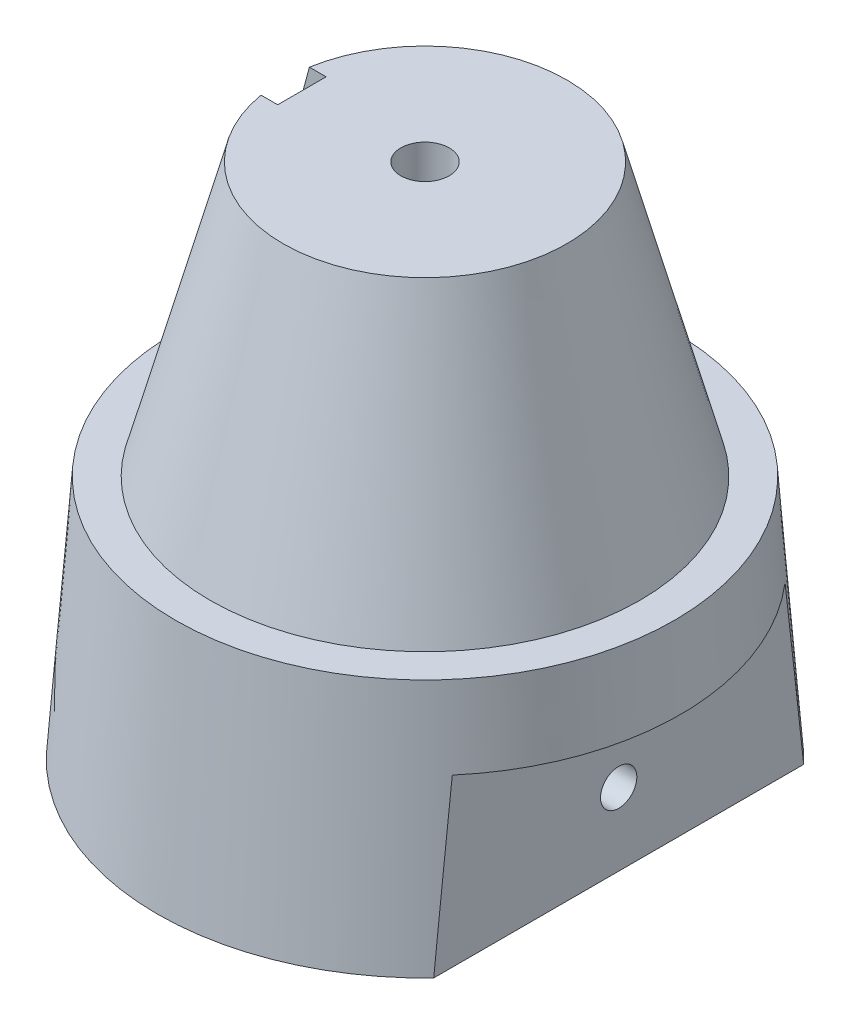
SolidWorks part; units mm, degrees
ref_plane "Plan de face" through (0, 0, 0) normal (0, 0, 1) x (1, 0, 0)
ref_plane "Plan de dessus" through (0, 0, 0) normal (0, 1, 0) x (1, 0, 0)
ref_plane "Plan de droite" through (0, 0, 0) normal (1, 0, 0) x (0, 0, -1)
sketch "Esquisse4" plane through (0, 0, 0) normal (1, 0, 0) x (0, 0, -1)
  line L0 (0, 85.5) -> (0, -46.6003) construction
  line L1 (0, 0) -> (44.25, 0)
  line L2 (41.2125, 40.5) -> (44.25, 0)
  line L5 (41.2125, 40.5) -> (35.5, 40.5)
  line L6 (35.5, 40.5) -> (23.4423, 85.5)
  line L7 (23.4423, 85.5) -> (0, 85.5)
  line L8 (0, 85.5) -> (0, 0)
  dimension "D1" = 45
  dimension "D2" = 85.5
  dimension "D3" = 88.5
  dimension "D5" = 71
  dimension "D6" = 15
  dimension "D8" = 82.425
revolve "Révolution1" add sketch "Esquisse4" angle 360 about L0
sketch "Esquisse10" plane through (0, 0, 0) normal (0, -1, 0) x (1, 0, 0)
  circle A0 centre (0, 0) radius 21
  dimension "D1" = 42
extrude "Enlèv. mat.-Extru.4" cut sketch "Esquisse10" against normal blind 65
sketch "Esquisse11" plane through (0, 65, 0) normal (0, -1, 0) x (1, 0, 0)
  circle A0 centre (0, 0) radius 23
  dimension "D1" = 46
extrude "Enlèv. mat.-Extru.5" cut sketch "Esquisse11" against normal blind 5
sketch "Esquisse15" plane through (0, 0, 0) normal (0, -1, 0) x (1, 0, 0)
  line L0 (0, 51.0694) -> (0, -50.5671) construction
  line L1 (-32, 48.5578) -> (32, 48.5578)
  line L2 (32, 48.5578) -> (32, -50.5671)
  line L3 (32, -50.5671) -> (-32, -50.5671)
  line L5 (-52.7438, -55.7577) -> (52.7438, -55.7577)
  line L6 (52.7438, -55.7577) -> (52.7438, 57.4321)
  line L7 (52.7438, 57.4321) -> (-52.7438, 57.4321)
  line L9 (-52.7438, -55.7577) -> (-52.7438, 57.4321)
  line L10 (-32, 48.5578) -> (-32, -50.5671)
  dimension "D1" = 64
extrude "Enlèv. mat.-Extru.6" cut sketch "Esquisse15" against normal blind 27.5
hole_wizard "Trou taraudé M102" positions "Esquisse17" profile "Esquisse18" tap size "M10" standard "ISO"
sketch "Esquisse17" plane through (0, 85.5, 0) normal (0, 1, 0) x (-1, 0, 0)
  point P1 (0, 0)
sketch "Esquisse18" plane through (0, 85.5, 0) normal (1, 0, 0) x (0, 0, 1)
  line L0 (0, 0) -> (0, 85.5)
  line L1 (0, 85.5) -> (4, 85.5)
  line L2 (4, 85.5) -> (4, 0)
  line L5 (4, 0) -> (0, 0)
  line L11 (0, -6.35) -> (0, 107.95) construction
  dimension "Diamètre du trou pour taraudage jusqu'au prochain" = 8
  dimension "Profondeur du trou pour taraudage jusqu'au prochain" = 85.5
sketch "Esquisse19" plane through (-32, 0, 0) normal (-1, 0, 0) x (0, 0, 1)
  line L0 (0, -4.75) -> (0, 90.9853) construction
hole_wizard "Trou taraudé M81" positions "Esquisse3D1" profile "Esquisse21" tap size "M8" standard "ISO"
sketch3d "Esquisse3D1"
  line L0 (-32, -4.75, 0) -> (-32, 90.9853, 0) construction
  line L1 (-32, 0, -30.5624) -> (-32, 0, 30.5624) construction
  point P0 (-32, 12, 0)
  dimension "D1" = 12
sketch "Esquisse21" plane through (-32, 12, 0) normal (0, 1, 0) x (0, 0, 1)
  line L0 (0, 0) -> (0, 74.1875)
  line L1 (0, 74.1875) -> (3, 74.1875)
  line L2 (3, 74.1875) -> (3, 0)
  line L5 (3, 0) -> (0, 0)
  line L11 (0, -6.35) -> (0, 107.95) construction
  dimension "Diamètre du trou pour taraudage jusqu'au prochain" = 6
  dimension "Profondeur du trou pour taraudage jusqu'au prochain" = 74.1875
sketch "Esquisse24" plane through (0, 85.5, 0) normal (0, 1, 0) x (1, 0, 0)
  line L0 (0, -28.1605) -> (0, 30.4438) construction
ref_plane "Plan3" through (-21.375, 5.7274, 0) normal (0.9659, -0.2588, 0) x (0, 0, -1)
ref_plane "Plan4" through (-43.2474, 11.5881, 0) normal (0.9659, -0.2588, 0) x (0, 0, -1)
sketch "Esquisse25" plane through (-43.2474, 11.5881, 0) normal (0.9659, -0.2588, 0) x (0, 0, -1)
  line L0 (0, 39.5193) -> (0, 92.908) construction
  line L1 (0, 77.5193) -> (-4, 77.5193)
  line L2 (-4, 77.5193) -> (-4, 39.5193)
  line L3 (-4, 39.5193) -> (4, 39.5193)
  line L4 (0, 77.5193) -> (4, 77.5193)
  line L5 (4, 77.5193) -> (4, 39.5193)
  dimension "D1" = 8
  dimension "D2" = 38
extrude "Enlèv. mat.-Extru.9" cut sketch "Esquisse25" along normal blind 3
fillet "Congé2" radius 4 2 edges at (-31.4565, 49.3422, 4) (-31.4565, 49.3422, -4)
